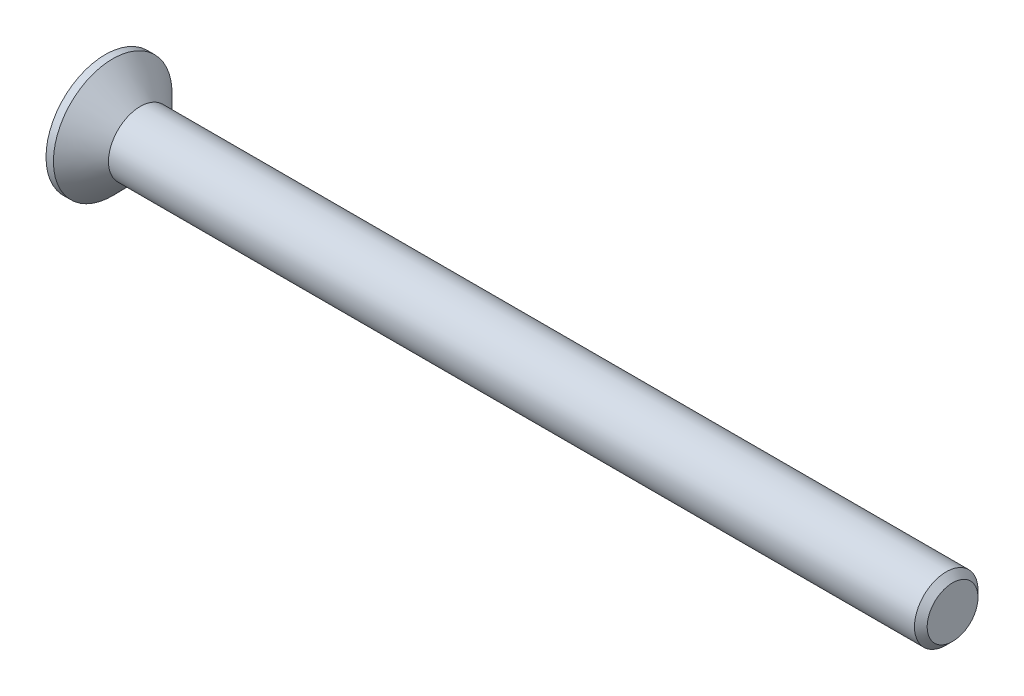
SolidWorks part; units mm, degrees
ref_plane "Front Plane" through (0, 0, 0) normal (0, 0, 1) x (1, 0, 0)
ref_plane "Top Plane" through (0, 0, 0) normal (0, 1, 0) x (1, 0, 0)
ref_plane "Right Plane" through (0, 0, 0) normal (1, 0, 0) x (0, 0, -1)
sketch "Sketch1" plane through (0, 0, 0) normal (0, 0, 1) x (1, 0, 0)
  line L1 (-1.65, 2.8) -> (-1.65, 0)
  line L2 (-1.65, 0) -> (38.35, 0)
  line L3 (38.35, 0) -> (38.35, 1.5)
  line L4 (38.35, 1.5) -> (0, 1.5)
  line L5 (-1.65, 2.8) -> (-1.3, 2.8)
  line L6 (-1.3, 2.8) -> (0, 1.5)
  dimension "D1" = 1.5
  dimension "D2" = 45
  dimension "D3" = 1.65
  dimension "D4" = 40
  dimension "D5" = 2.8
revolve "Revolve1" add sketch "Sketch1" angle 360 about L2
chamfer "Chamfer1" distance 0.3 angle 45 1 edges at (38.35, 0, 1.5)
sketch "Sketch2" plane through (-1.65, 0, 0) normal (-1, 0, 0) x (0, 0, 1)
  line L0 (-0.365, 1.45) -> (0.365, 1.45)
  line L1 (0.365, 1.45) -> (0.365, 0.365)
  line L2 (0.365, 0.365) -> (1.45, 0.365)
  line L3 (1.45, 0.365) -> (1.45, -0.365)
  line L4 (1.45, -0.365) -> (0.365, -0.365)
  line L5 (0.365, -0.365) -> (0.365, -1.45)
  line L6 (0.365, -1.45) -> (-0.365, -1.45)
  line L7 (-0.365, -1.45) -> (-0.365, -0.365)
  line L8 (-0.365, -0.365) -> (-1.45, -0.365)
  line L9 (-1.45, -0.365) -> (-1.45, 0.365)
  line L10 (-1.45, 0.365) -> (-0.365, 0.365)
  line L11 (-0.365, 0.365) -> (-0.365, 1.45)
  point P2 (0, 1.45)
  point P14 (0, -1.45)
  point P15 (1.45, 0)
  point P16 (-1.45, 0)
  dimension "D1" = 2.9
  dimension "D2" = 0.73
extrude "Cut-Extrude1" cut sketch "Sketch2" against normal blind 1.25
